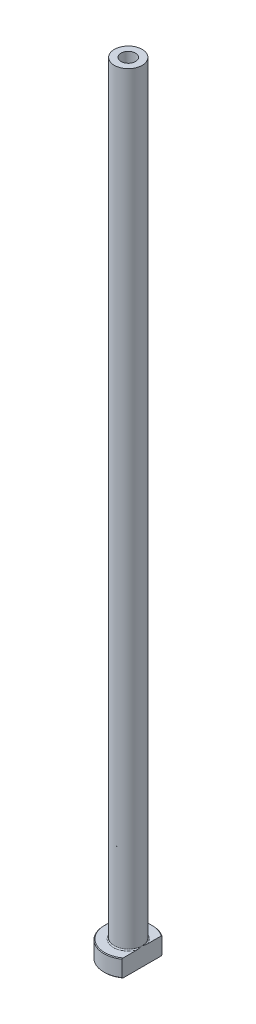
SolidWorks part; units mm, degrees
ref_plane "Front Plane" through (0, 0, 0) normal (0, 0, 1) x (1, 0, 0)
ref_plane "Top Plane" through (0, 0, 0) normal (0, 1, 0) x (1, 0, 0)
ref_plane "Right Plane" through (0, 0, 0) normal (1, 0, 0) x (0, 0, -1)
sketch "Sketch1" plane through (0, 0, 0) normal (0, 0, 1) x (1, 0, 0)
  line L0 (-2.1, 225) -> (-4, 225)
  line L1 (-4, 225) -> (-4, 5)
  line L2 (-4, 5) -> (-7, 5)
  line L3 (-7, 5) -> (-7, 0)
  line L4 (6.05, 0) -> (-6.05, 0) construction
  line L5 (-7, 0) -> (-2.35, 0)
  line L6 (-2.1, 180) -> (-2.1, 225)
  line L7 (0, 92.1877) -> (0, -15.5353) construction
  line L8 (0, -7.7) -> (0, 7.7) construction
  line L9 (-2.1, 180) -> (-2.35, 168)
  line L10 (-2.35, 168) -> (-2.35, 0)
  dimension "D1" = 0.25
  dimension "ID" = 4.2
  dimension "OD" = 8
  dimension "L" = 225
  dimension "H" = 14
  dimension "T" = 5
  dimension "N" = 45
  dimension "D2" = 12
  dimension "L-N" = 180
revolve "Revolve1" add sketch "Sketch1" angle 360 about L7
fillet "Fillet1" radius 0.3 1 edges at (0, 5, 4)
chamfer "Chamfer1" distance 0.2 angle 45 2 edges at (0, 5, 7) (0, 0, 7)
sketch "Sketch2" plane through (0, 0, 0) normal (0, -1, 0) x (1, 0, 0)
  line L0 (4, 5.7446) -> (4, -5.7446)
  circle A0 centre (0, 0) radius 7 construction
  arc A1 (4, 5.7446) -> (4, -5.7446) centre (0, 0) cw
  circle A2 centre (0, 0) radius 4 construction
extrude "Cut-Extrude1" cut sketch "Sketch2" against normal through all
chamfer "Chamfer2" distance 0.5 angle 45 1 edges at (0, 0, 2.35)
